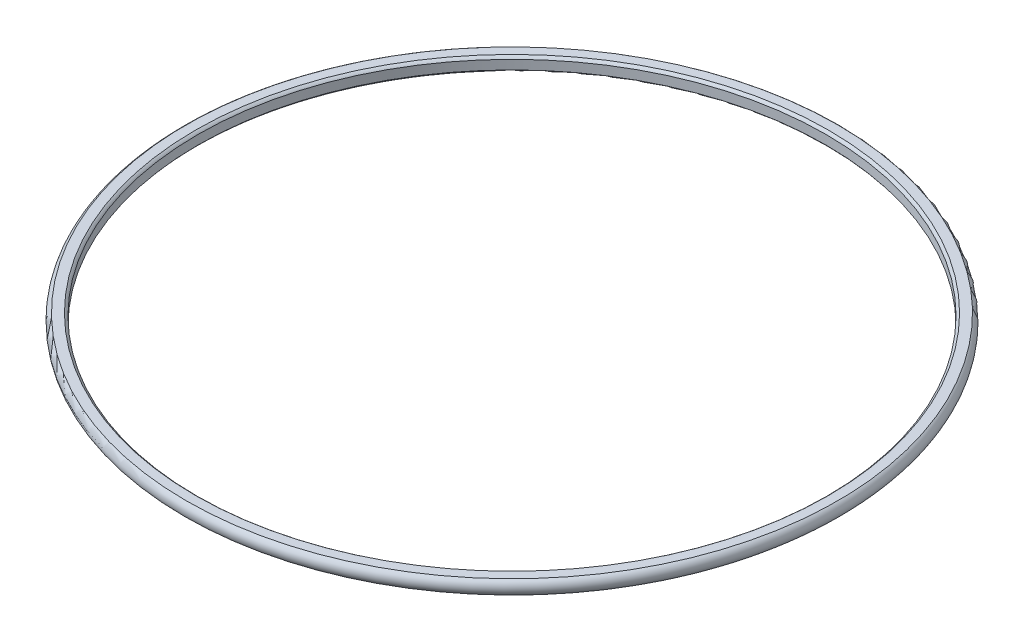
SolidWorks part; units mm, degrees
ref_plane "Piano frontale" through (0, 0, 0) normal (0, 0, 1) x (1, 0, 0)
ref_plane "Piano superiore" through (0, 0, 0) normal (0, 1, 0) x (1, 0, 0)
ref_plane "Piano destro" through (0, 0, 0) normal (1, 0, 0) x (0, 0, -1)
sketch "Schizzo1" plane through (0, 0, 0) normal (0, 0, 1) x (1, 0, 0)
  line L0 (0, 0) -> (0, -13.347) construction
  line L1 (0, 0) -> (33.5, 0) construction
  line L4 (33.5, -2.5) -> (36, 0) construction
  line L5 (33.5, 0) -> (34.75, -1.25) construction
  line L6 (33.7652, 0) -> (34.7449, 0)
  line L7 (33.5, -0.2652) -> (33.5, -1.2449)
  line L8 (33.5, 0) -> (33.5, -2.5) construction
  line L9 (33.5, 0) -> (36, 0) construction
  arc A0 (33.7652, 0) -> (33.5, -0.2652) centre (34.255, -0.755) ccw
  arc A1 (33.5, -1.2449) -> (34.7449, 0) centre (34.255, -0.755) ccw
  dimension "D4" = 1.8
  dimension "D1" = 33.5
  dimension "D2" = 2.5
  dimension "D3" = 2.5
  dimension "D5" = 0.7
revolve "Rivoluzione1" add sketch "Schizzo1" angle 360 about L0
